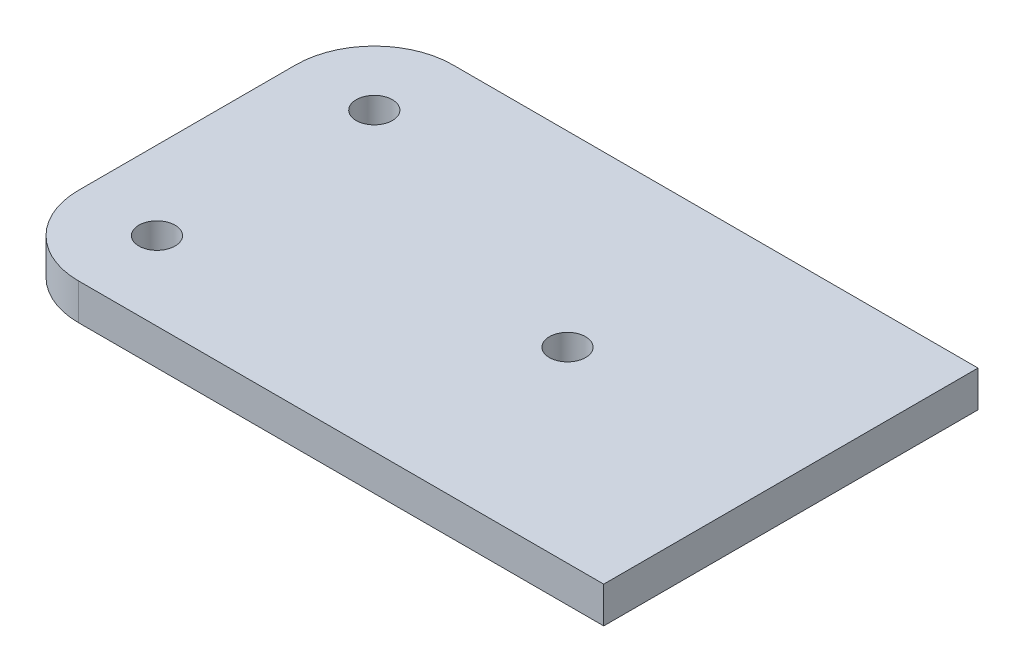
SolidWorks part; units mm, degrees
ref_plane "Front" through (0, 0, 0) normal (0, 0, 1) x (1, 0, 0)
ref_plane "Top" through (0, 0, 0) normal (0, 1, 0) x (1, 0, 0)
ref_plane "Right" through (0, 0, 0) normal (1, 0, 0) x (0, 0, -1)
sketch "Sketch1" plane through (0, 0, 0) normal (0, 1, 0) x (1, 0, 0)
  line L1 (13, 0) -> (100, 0)
  line L2 (0, 13) -> (0, 49)
  line L3 (13, 62) -> (100, 62)
  line L4 (100, 0) -> (100, 62)
  circle A0 centre (13, 49) radius 3
  circle A1 centre (13, 13) radius 3
  circle A3 centre (63, 31) radius 3
  arc A4 (0, 49) -> (13, 62) centre (13, 49) cw
  arc A5 (13, 0) -> (0, 13) centre (13, 13) cw
  point P9 (0, 0)
extrude "Extrude1" add sketch "Sketch1" along normal blind 6
